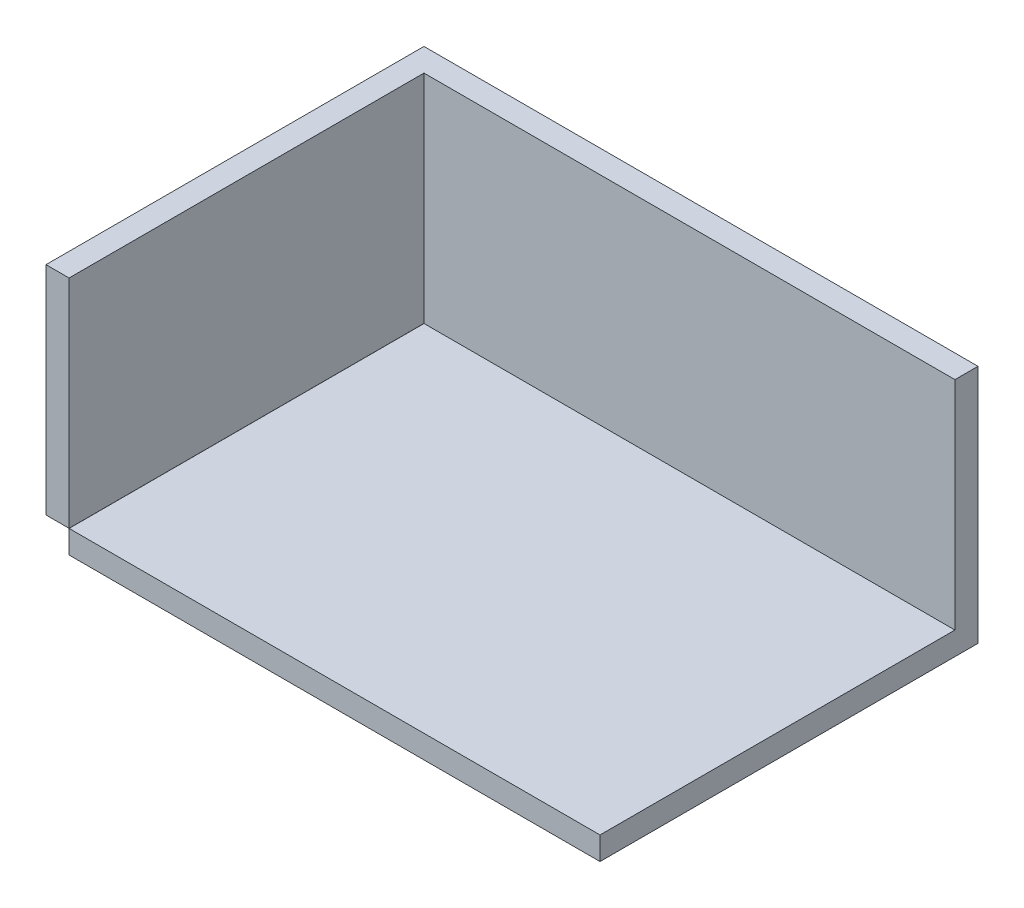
SolidWorks part; units mm, degrees
ref_plane "Front" through (0, 0, 0) normal (0, 0, 1) x (1, 0, 0)
ref_plane "Top" through (0, 0, 0) normal (0, 1, 0) x (1, 0, 0)
ref_plane "Right" through (0, 0, 0) normal (1, 0, 0) x (0, 0, -1)
sketch "Sketch1" plane through (0, 0, 0) normal (0, 1, 0) x (1, 0, 0)
  line L1 (-59.6577, 39.8341) -> (60.4058, 39.8341)
  line L2 (-59.6577, 39.8341) -> (-59.6577, -42.0783)
  line L3 (-59.6577, -42.0783) -> (60.4058, -42.0783)
  line L4 (60.4058, 39.8341) -> (60.4058, -42.0783)
extrude "Extrude1" add sketch "Sketch1" along normal blind 52
shell "Shell1" thickness 5
rip "Rip1" parameters "Thickness"=1
